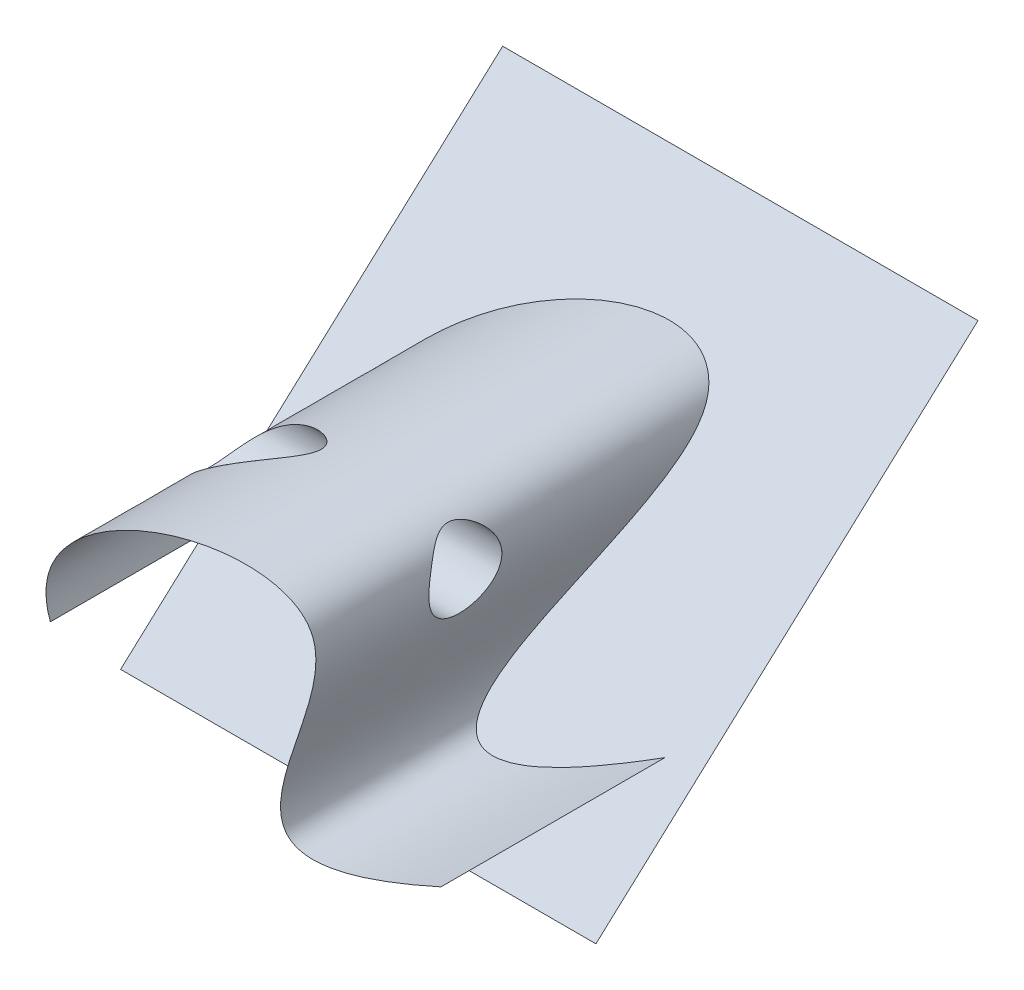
SolidWorks part; units mm, degrees
ref_plane "Front Plane" through (0, 0, 0) normal (0, 0, 1) x (1, 0, 0)
ref_plane "Top Plane" through (0, 0, 0) normal (0, 1, 0) x (1, 0, 0)
ref_plane "Right Plane" through (0, 0, 0) normal (1, 0, 0) x (0, 0, -1)
sketch "Sketch1" plane through (0, 0, 0) normal (0, 0, 1) x (1, 0, 0)
  spline S0 degree 3 poles (-84.2134, -23.6341) (-103.0836, 26.848) (136.3153, 98.7207) (-35.8834, -96.9735) (92.3631, -39.1185) knots 0 0 0 0 0.513155 1 1 1 1
surface "Surface-Extrude1" sketch "Sketch1" parameters "D1"=214.884
sketch "Sketch2" plane through (0, 0, 0) normal (1, 0, 0) x (0, 0, -1)
  line L0 (227.6919, 76.2692) -> (54.9778, -81.3556)
surface "Surface-Extrude2" sketch "Sketch2" parameters "D1"=214.884
sketch "Sketch3" plane through (0, 0, 0) normal (1, 0, 0) x (0, 0, -1)
  circle A0 centre (67.6019, 21.0708) radius 16.4934
surface "Surface-Extrude3" sketch "Sketch3" parameters "D1"=177.292
surface "Surface-Trim4"
surface "Surface-Trim5"
surface "Surface-Trim6"
